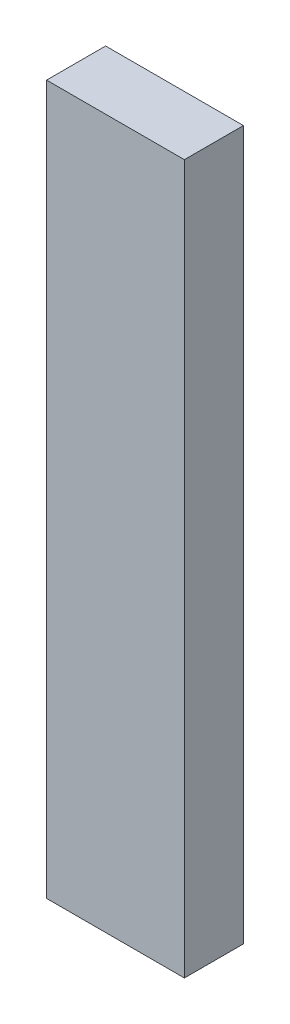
SolidWorks part; units mm, degrees
ref_plane "Front Plane" through (0, 0, 0) normal (0, 0, 1) x (1, 0, 0)
ref_plane "Top Plane" through (0, 0, 0) normal (0, 1, 0) x (1, 0, 0)
ref_plane "Right Plane" through (0, 0, 0) normal (1, 0, 0) x (0, 0, -1)
sketch "Sketch1" plane through (0, 0, 0) normal (0, 1, 0) x (1, 0, 0)
  line L1 (-44.45, 19.05) -> (44.45, 19.05)
  line L2 (-44.45, 19.05) -> (-44.45, -19.05)
  line L3 (-44.45, -19.05) -> (44.45, -19.05)
  line L4 (44.45, 19.05) -> (44.45, -19.05)
  line L5 (-44.45, 19.05) -> (44.45, -19.05) construction
  line L6 (-44.45, -19.05) -> (44.45, 19.05) construction
  point P0 (0, 0)
  dimension "D1" = 88.9
  dimension "D2" = 38.1
extrude "Boss-Extrude1" add sketch "Sketch1" along normal blind 457.2
sketch "Sketch2" [suppressed] plane through (0, 0, -19.05) normal (0, 0, -1) x (-1, 0, 0)
  line L0 (44.45, 457.2) -> (44.45, 247.65) construction
  line L1 (44.45, 457.2) -> (44.45, 0) construction
  line L3 (44.45, 247.65) -> (-44.45, 247.65)
  line L4 (44.45, 247.65) -> (44.45, 0)
  line L5 (44.45, 0) -> (-44.45, 0)
  line L6 (-44.45, 247.65) -> (-44.45, 0)
  dimension "D1" = 209.55
extrude "Cut-Extrude1" [suppressed] cut sketch "Sketch2" against normal through all
sketch "Sketch3" [suppressed] plane through (0, 0, 0) normal (0, -1, 0) x (-1, 0, 0)
  line L0 (44.45, -19.05) -> (37.7319, 19.05)
  line L1 (-44.45, 19.05) -> (44.45, 19.05) construction
  line L2 (37.7319, 19.05) -> (44.45, 19.05)
  line L3 (44.45, 19.05) -> (44.45, -19.05)
  dimension "D1" = 10
extrude "Cut-Extrude2" [suppressed] cut sketch "Sketch3" against normal through all
